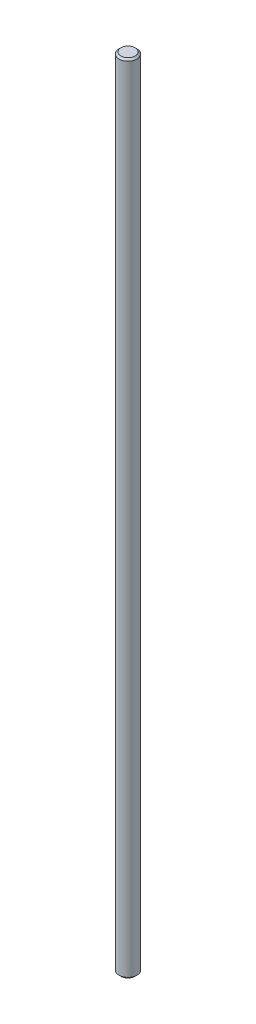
SolidWorks part; units mm, degrees
ref_plane "Front" through (0, 0, 0) normal (0, 0, 1) x (1, 0, 0)
ref_plane "Top" through (0, 0, 0) normal (0, 1, 0) x (1, 0, 0)
ref_plane "Right" through (0, 0, 0) normal (1, 0, 0) x (0, 0, -1)
sketch "Sketch1" plane through (0, 0, 0) normal (0, 1, 0) x (1, 0, 0)
  circle A0 centre (0, 0) radius 2
  dimension "D1" = 4
extrude "Extrude1" add sketch "Sketch1" along normal blind 178
chamfer "Chamfer1" distance 0.4 angle 45 2 edges at (0, 0, 2) (0, 178, 2)
